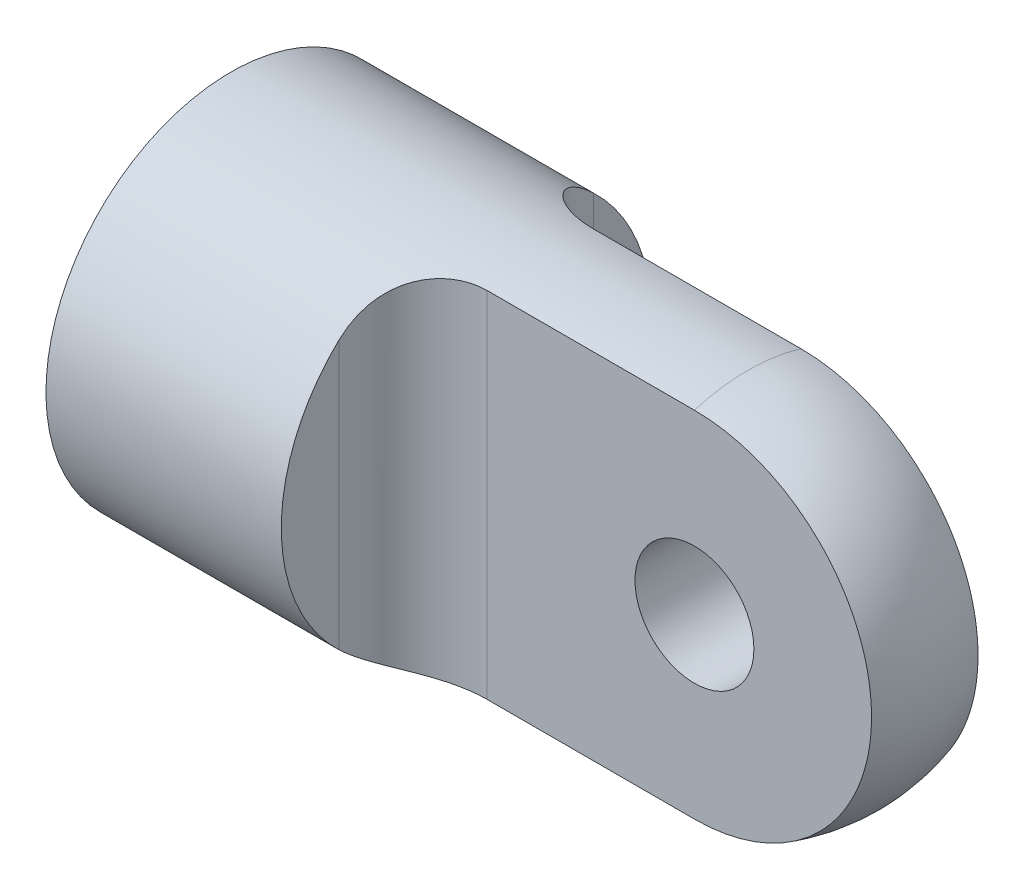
SolidWorks part; units mm, degrees
ref_plane "Front Plane" through (0, 0, 0) normal (0, 0, 1) x (1, 0, 0)
ref_plane "Top Plane" through (0, 0, 0) normal (0, 1, 0) x (1, 0, 0)
ref_plane "Right Plane" through (0, 0, 0) normal (1, 0, 0) x (0, 0, -1)
sketch "Sketch1" plane through (0, 0, 0) normal (0, 0, 1) x (1, 0, 0)
  line L0 (0, 6.2056) -> (0, 0) construction
  line L1 (-15.0622, 0) -> (15.0622, 0)
  line L2 (-15.0622, 0) -> (-15.0622, 7.9375)
  line L3 (-15.0622, 7.9375) -> (7.1247, 7.9375)
  arc A0 (15.0622, 0) -> (7.1247, 7.9375) centre (7.1247, 0) ccw
  dimension "D1" = 7.9375
  dimension "D2" = 30.1244
revolve "Revolve1" add sketch "Sketch1" angle 360 about L1
sketch "Sketch2" plane through (0, 0, 0) normal (0, 1, 0) x (1, 0, 0)
  line L0 (15.0622, 0) -> (-6.934, 0) construction
  line L1 (7.1247, 7.9375) -> (-15.0622, 7.9375) construction
  line L2 (-15.0622, -7.9375) -> (7.1247, -7.9375) construction
  line L3 (7.1247, 7.9375) -> (-4.9591, 7.9375)
  line L4 (-4.9591, -7.9375) -> (7.1247, -7.9375)
  line L5 (14.7259, 2.286) -> (-1.7841, 2.286)
  line L6 (14.7259, -2.286) -> (-1.7841, -2.286)
  line L7 (-4.9591, 5.461) -> (-4.9591, 7.9375)
  line L8 (-4.9591, -5.461) -> (-4.9591, -7.9375)
  line L9 (15.0622, 2.286) -> (-6.934, 2.286) construction
  line L10 (15.0622, -2.286) -> (-6.934, -2.286) construction
  arc A0 (7.1247, -7.9375) -> (7.1247, 7.9375) centre (7.1247, 0) ccw construction
  arc A1 (7.1247, -7.9375) -> (14.7259, -2.286) centre (7.1247, 0) ccw
  arc A2 (14.7259, 2.286) -> (7.1247, 7.9375) centre (7.1247, 0) ccw
  arc A3 (-4.9591, -5.461) -> (-1.7841, -2.286) centre (-1.7841, -5.461) cw
  arc A4 (-4.9591, 5.461) -> (-1.7841, 2.286) centre (-1.7841, 5.461) ccw
  dimension "D4" = 3.175
  dimension "D3" = 19.685
  dimension "D1" = 2.286
  dimension "D2" = 4.572
extrude "Cut-Extrude1" cut sketch "Sketch2" against normal mid plane 254
sketch "Sketch3" plane through (0, 0, 2.286) normal (0, 0, 1) x (1, 0, 0)
  line L0 (7.1247, 0) -> (-1.7841, 0) construction
  line L1 (-1.7841, -7.6012) -> (-1.7841, 7.6012) construction
  arc A0 (7.1247, -7.6012) -> (7.1247, 7.6012) centre (7.1247, 0) ccw construction
  arc A1 (7.1247, -7.6012) -> (7.1247, 7.6012) centre (7.1247, 0) ccw
hole_wizard "#10 Clearance Hole1" positions "3DSketch1" profile "Sketch4" hole size "#10" standard "ANSI Inch"
sketch3d "3DSketch1"
  point P0 (7.1247, 0, 2.286)
sketch "Sketch4" plane through (7.1247, 0, 2.286) normal (1, 0, 0) x (0, -1, 0)
  line L0 (0, 0) -> (0, 10.2235)
  line L1 (0, 10.2235) -> (2.5527, 10.2235)
  line L2 (2.5527, 10.2235) -> (2.5527, 0)
  line L5 (2.5527, 0) -> (0, 0)
  line L11 (0, -6.35) -> (0, 107.95) construction
  dimension "Thru Hole Dia." = 5.1054
  dimension "Thru Hole Depth" = 10.2235
sketch "Sketch5" plane through (-15.0622, 0, 0) normal (-1, 0, 0) x (0, 0, 1)
  line L0 (0, 0) -> (0, 7.9375) construction
  circle A0 centre (0, 0) radius 7.9375 construction
hole_wizard "Tapped Hole for #10-32 Helicoil1" positions "3DSketch4" profile "Sketch8" tap size "#10-32" standard "Helicoil® Inch"
sketch3d "3DSketch4"
  point P0 (-15.0622, 0, 0)
sketch "Sketch8" plane through (-15.0622, 0, 0) normal (0, 1, 0) x (0, 0, 1)
  line L0 (0, 0) -> (0, 11.0588)
  line L1 (0, 11.0588) -> (2.5527, 9.525)
  line L2 (2.5527, 9.525) -> (2.5527, 0)
  line L5 (2.5527, 0) -> (0, 0)
  line L10 (0, 11.0588) -> (-2.5527, 9.525) construction
  line L11 (0, -6.35) -> (0, 107.95) construction
  dimension "Tap Drill Dia." = 5.1054
  dimension "Tap Drill Depth" = 9.525
  dimension "Drill Angle" = 118
